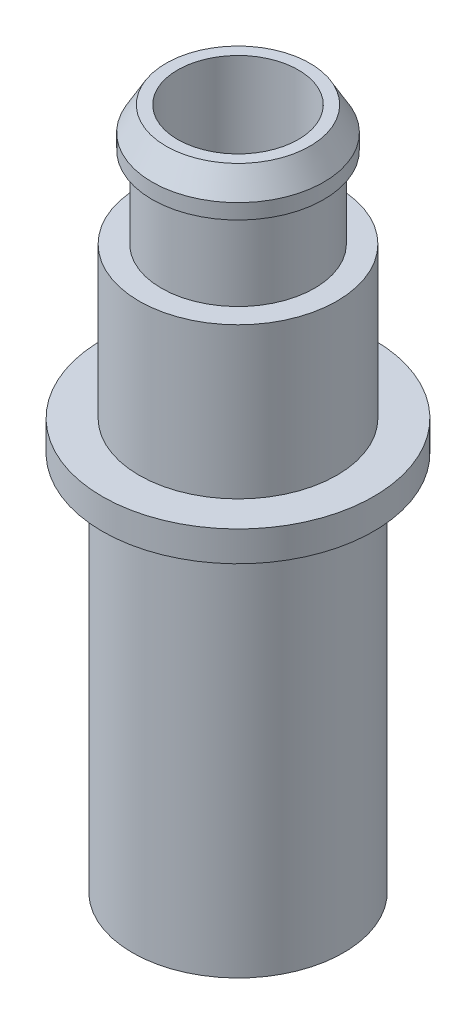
SolidWorks part; units mm, degrees
ref_plane "Front Plane" through (0, 0, 0) normal (0, 0, 1) x (1, 0, 0)
ref_plane "Top Plane" through (0, 0, 0) normal (0, 1, 0) x (1, 0, 0)
ref_plane "Right Plane" through (0, 0, 0) normal (1, 0, 0) x (0, 0, -1)
sketch "Sketch1" plane through (0, 0, 0) normal (0, 1, 0) x (1, 0, 0)
  circle A0 centre (0, 0) radius 22.225
  circle A1 centre (0, 0) radius 12.7
  dimension "D1" = 44.45
  dimension "D2" = 25.4
extrude "Boss-Extrude1" add sketch "Sketch1" against normal blind 80.01
sketch "Sketch2" plane through (0, 0, 0) normal (0, 1, 0) x (1, 0, 0)
  circle A0 centre (0, 0) radius 28.575
  circle A1 centre (0, 0) radius 12.7
  dimension "D1" = 57.15
  dimension "D2" = 25.4
extrude "Boss-Extrude2" add sketch "Sketch2" along normal blind 6.35
sketch "Sketch4" plane through (0, 6.35, 0) normal (0, 1, 0) x (1, 0, 0)
  circle A0 centre (0, 0) radius 20.828
  circle A1 centre (0, 0) radius 12.7
  dimension "D1" = 41.656
extrude "Boss-Extrude4" add sketch "Sketch4" along normal blind 31.75
sketch "Sketch3" plane through (0, 38.1, 0) normal (0, 1, 0) x (1, 0, 0)
  circle A0 centre (0, 0) radius 16.129
  circle A1 centre (0, 0) radius 12.7
extrude "Boss-Extrude3" add sketch "Sketch3" along normal blind 25.4
sketch "Sketch5" plane through (0, 63.5, 0) normal (0, 1, 0) x (1, 0, 0)
  circle A0 centre (0, 0) radius 12.7
  circle A1 centre (0, 0) radius 18.0721
  dimension "D1" = 36.1442
extrude "Boss-Extrude5" add sketch "Sketch5" against normal blind 8.255
chamfer "Chamfer1" distance 5.08 angle 30 1 edges at (0, 63.5, 18.0721)
